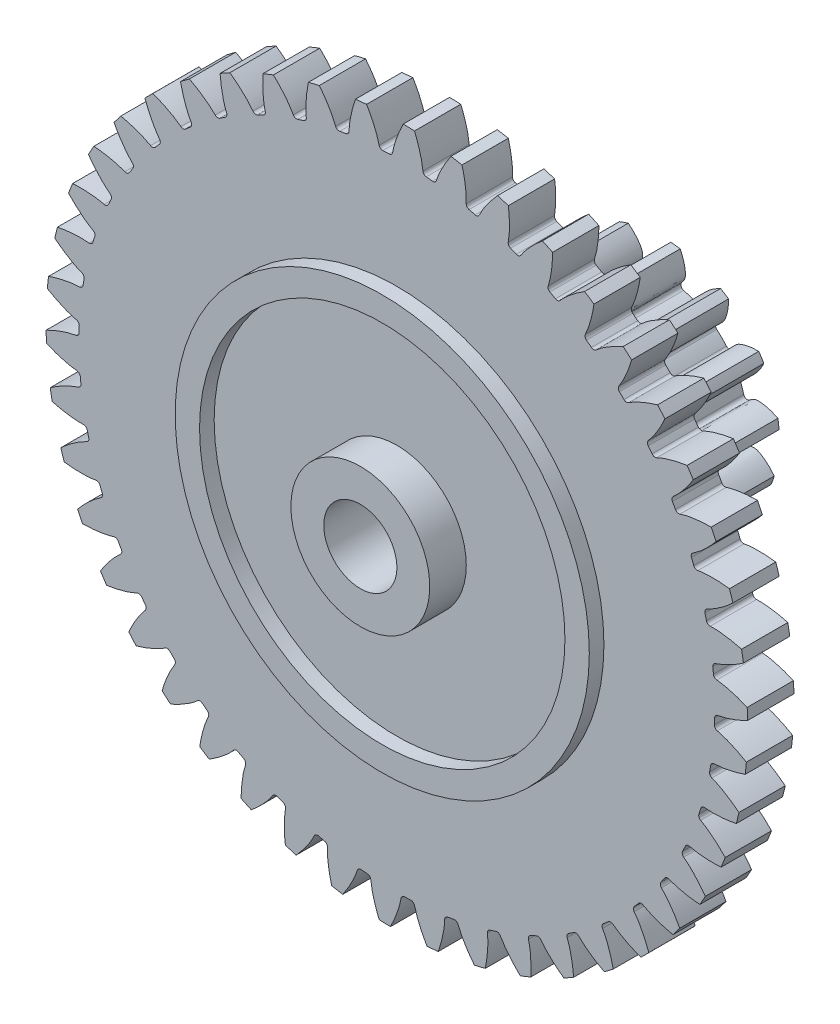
SolidWorks part; units mm, degrees
ref_plane "Face" through (0, 0, 0) normal (0, 0, 1) x (1, 0, 0)
ref_plane "Dessus" through (0, 0, 0) normal (0, 1, 0) x (1, 0, 0)
ref_plane "Droite" through (0, 0, 0) normal (1, 0, 0) x (0, 0, -1)
other "Joindre1"
other "Roue Z2 m=0,3 Z=46<1>@Z2-Z3"
other "Roue Z3 m=0,3 Z=14<3>@Z2-Z3"
sketch "Dp" plane through (0, 0, 0) normal (0, 0, 1) x (1, 0, 0)
  circle A0 centre (0, 0) radius 6.9 construction
  circle A1 centre (0, 0) radius 1.5 construction
  dimension "D1" = 13.8
  dimension "D2" = 3
